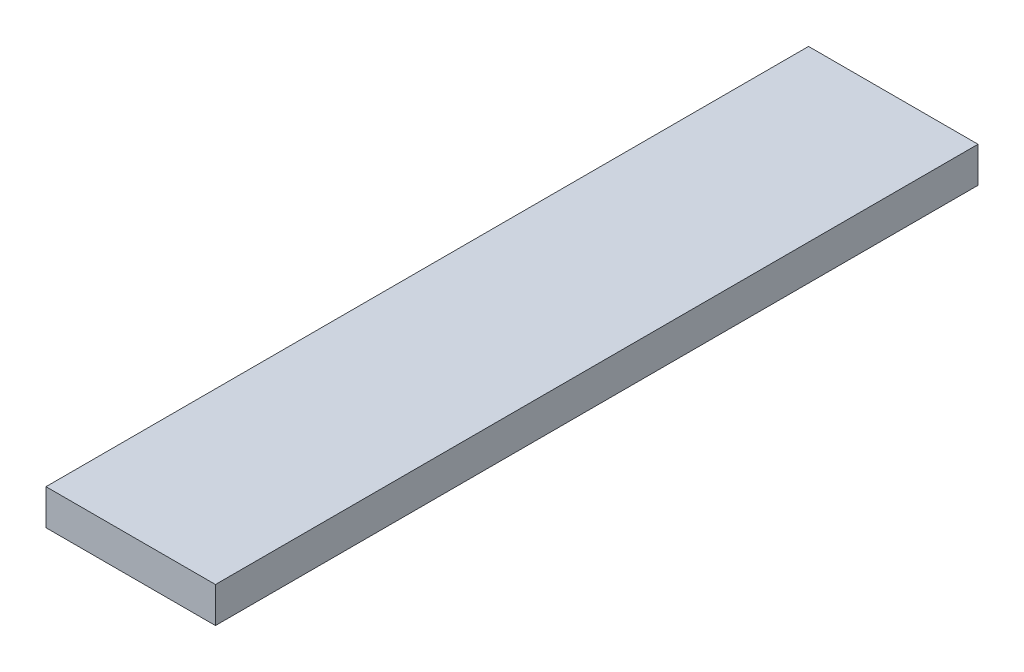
SolidWorks part; units mm, degrees
ref_plane "Plan de face" through (0, 0, 0) normal (0, 0, 1) x (1, 0, 0)
ref_plane "Plan de dessus" through (0, 0, 0) normal (0, 1, 0) x (1, 0, 0)
ref_plane "Plan de droite" through (0, 0, 0) normal (1, 0, 0) x (0, 0, -1)
sketch "Esquisse1" plane through (0, 0, 0) normal (0, 0, 1) x (1, 0, 0)
  line L1 (0, 0) -> (100, 0)
  line L2 (0, 0) -> (0, -21)
  line L3 (0, -21) -> (100, -21)
  line L4 (100, 0) -> (100, -21)
  dimension "D1" = 100
  dimension "D2" = 21
extrude "Extrusion1" add sketch "Esquisse1" along normal blind 450
